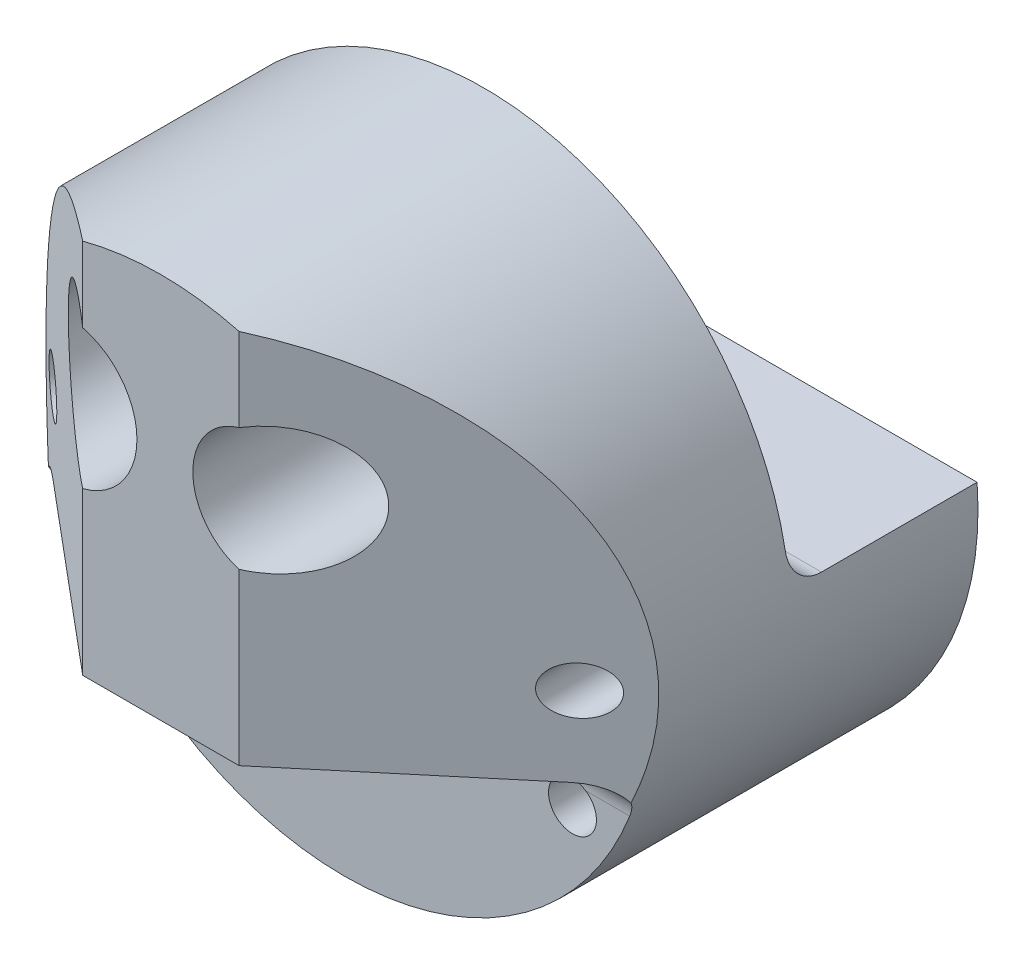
SolidWorks part; units mm, degrees
ref_plane "Front Plane" through (0, 0, 0) normal (0, 0, 1) x (1, 0, 0)
ref_plane "Top Plane" through (0, 0, 0) normal (0, 1, 0) x (1, 0, 0)
ref_plane "Right Plane" through (0, 0, 0) normal (1, 0, 0) x (0, 0, -1)
sketch "Sketch1" plane through (0, 0, 0) normal (0, 0, 1) x (1, 0, 0)
  circle A0 centre (0, 0) radius 60.96
  dimension "D1" = 121.92
extrude "Boss-Extrude1" add sketch "Sketch1" along normal blind 101.6
sketch "Sketch3" plane through (0, 0, 0) normal (0, 1, 0) x (1, 0, 0)
  line L0 (60.96, -63.5) -> (60.96, -101.6)
  line L1 (60.96, -101.6) -> (60.96, 0) construction
  line L2 (60.96, -101.6) -> (15.5542, -101.6)
  line L3 (-60.96, -101.6) -> (60.96, -101.6) construction
  line L4 (15.5542, -101.6) -> (60.96, -63.5)
  line L5 (60.96, -63.5) -> (-60.96, -63.5) construction
  line L6 (-60.96, 0) -> (-60.96, -101.6) construction
  line L7 (-60.96, -63.5) -> (-15.5542, -101.6)
  line L8 (-15.5542, -101.6) -> (-60.96, -101.6)
  line L9 (-60.96, -101.6) -> (-60.96, -63.5)
  dimension "D1" = 50
  dimension "D2" = 50
  dimension "D3" = 38.1
extrude "Cut-Extrude1" cut sketch "Sketch3" against normal through all and the other way through all
hole_wizard "1 (1) Diameter Hole1" positions "Sketch6" profile "Sketch5" hole size "1" standard "Ansi Inch"
sketch "Sketch6" plane through (0, 0, 0) normal (0, 0, -1) x (-1, 0, 0)
  point P4 (-19.05, 30.1625)
  dimension "D1" = 30.1625
  dimension "D3" = 19.05
sketch "Sketch5" plane through (19.05, 30.1625, 0) normal (1, 0, 0) x (0, 1, 0)
  line L0 (0, 0) -> (0, 101.6)
  line L1 (0, 101.6) -> (12.7, 101.6)
  line L2 (12.7, 101.6) -> (12.7, 0)
  line L5 (12.7, 0) -> (0, 0)
  line L11 (0, -6.35) -> (0, 107.95) construction
  dimension "Thru Hole Dia." = 25.4
  dimension "Thru Hole Depth" = 101.6
hole_wizard "1 1/8 Diameter Hole3" positions "Sketch15" profile "Sketch14" hole size "1" standard "ANSI Inch"
sketch "Sketch15" plane through (0, 0, 0) normal (0, 0, -1) x (-1, 0, 0)
  point P0 (19.05, 30.1625)
  dimension "D1" = 30.1625
  dimension "D2" = 19.05
sketch "Sketch14" plane through (-19.05, 30.1625, 0) normal (1, 0, 0) x (0, 1, 0)
  line L0 (0, 0) -> (0, 101.6)
  line L1 (0, 101.6) -> (14.2875, 101.6)
  line L2 (14.2875, 101.6) -> (14.2875, 0)
  line L5 (14.2875, 0) -> (0, 0)
  line L11 (0, -6.35) -> (0, 107.95) construction
  dimension "Thru Hole Dia." = 28.575
  dimension "Thru Hole Depth" = 101.6
sketch "Sketch4" plane through (0, 0, 0) normal (1, 0, 0) x (0, 0, -1)
  line L0 (0, 60.96) -> (-101.6, 60.96) construction
  line L1 (-37.3062, 60.96) -> (0, 60.96)
  line L2 (-37.3062, 60.96) -> (-37.3062, 11.1125)
  line L3 (-30.9562, 4.7625) -> (0, 4.7625)
  line L4 (0, 60.96) -> (0, 4.7625)
  line L6 (0, -60.96) -> (0, 60.96) construction
  arc A0 (-37.3062, 11.1125) -> (-30.9562, 4.7625) centre (-30.9562, 11.1125) ccw
  dimension "D1" = 6.35
  dimension "D3" = 4.7625
  dimension "D2" = 37.3062
extrude "Cut-Extrude2" cut sketch "Sketch4" against normal through all and the other way through all
sketch "Sketch7" plane through (0, 0, 0) normal (1, 0, 0) x (0, 0, -1)
  line L0 (-101.6, -60.96) -> (0, -60.96) construction
  line L1 (0, -31.75) -> (-33.3375, -31.75)
  line L2 (0, -31.75) -> (0, -60.96)
  line L3 (0, -60.96) -> (-39.6875, -60.96)
  line L4 (-39.6875, -38.1) -> (-39.6875, -60.96)
  line L5 (0, -60.96) -> (0, 4.7625) construction
  arc A0 (-33.3375, -31.75) -> (-39.6875, -38.1) centre (-33.3375, -38.1) ccw
  dimension "D3" = 6.35
  dimension "D1" = 31.75
  dimension "D2" = 39.6875
extrude "Cut-Extrude3" cut sketch "Sketch7" against normal mid plane 80.9625
sketch "Sketch8" plane through (0, 0, 0) normal (1, 0, 0) x (0, 0, -1)
  line L0 (-101.6, -60.96) -> (-39.6875, -60.96) construction
  line L1 (-65.0875, -60.96) -> (-101.6, -60.96)
  line L2 (-65.0875, -60.96) -> (-65.0875, -22.225)
  line L3 (-71.4375, -15.875) -> (-101.6, -15.875)
  line L4 (-101.6, -60.96) -> (-101.6, -15.875)
  line L5 (-37.3062, 60.96) -> (-101.6, 60.96) construction
  line L6 (-76.2, 60.96) -> (-101.6, 60.96) construction
  line L7 (-76.2, 60.96) -> (-76.2, 53.975) construction
  line L8 (-82.55, 47.625) -> (-101.6, 47.625) construction
  line L9 (-101.6, 60.96) -> (-101.6, 47.625) construction
  line L10 (-101.6, 44.0157) -> (-101.6, 58.9422) construction
  line L11 (-101.6, -58.9422) -> (-101.6, 16.3093) construction
  arc A0 (-65.0875, -22.225) -> (-71.4375, -15.875) centre (-71.4375, -22.225) ccw
  arc A1 (-76.2, 53.975) -> (-82.55, 47.625) centre (-82.55, 53.975) cw construction
  dimension "D3" = 6.35
  dimension "D4" = 6.35
  dimension "D1" = 15.875
  dimension "D2" = 36.5125
  dimension "D5" = 47.625
  dimension "D6" = 25.4
extrude "Cut-Extrude4" cut sketch "Sketch8" against normal through all and the other way through all
fillet "Fillet2" radius 6.35 6 edges at (40.4812, -31.75, 16.6688) (40.4812, -33.6099, 37.8276) (-40.4812, -31.75, 16.6688) (-40.4812, -33.6099, 37.8276) (40.4812, -41.8392, 39.6875) (-40.4812, -41.8392, 39.6875)
sketch "Sketch9" plane through (0, 0, 0) normal (0, 0, -1) x (-1, 0, 0)
  line L0 (0, 0) -> (-45.3689, -26.1938) construction
  line L1 (0, 0) -> (-70.3391, 0) construction
  line L2 (0, 0) -> (45.3689, -26.1938) construction
  line L3 (0, 0) -> (74.2481, 0) construction
  circle A0 centre (-52.3875, 0) radius 4.7625
  circle A1 centre (0, 0) radius 52.3875 construction
  circle A2 centre (52.3875, 0) radius 4.7625
  circle A3 centre (45.3689, -26.1938) radius 4.7625
  circle A4 centre (-45.3689, -26.1938) radius 4.7625
  dimension "D3" = 9.525
  dimension "D4" = 104.775
  dimension "D1" = 30
  dimension "D2" = 30
extrude "Cut-Extrude5" cut sketch "Sketch9" against normal through all from offset 57.15
hole_wizard "#10 Clearance Hole1" positions "Sketch11" profile "Sketch10" hole size "#10" standard "Ansi Inch"
sketch "Sketch11" plane through (0, 0, 0) normal (0, 0, -1) x (-1, 0, 0)
  point P0 (-52.3875, 0)
  point P3 (-45.3689, -26.1938)
  point P6 (45.3689, -26.1938)
  point P9 (52.3875, 0)
sketch "Sketch10" plane through (52.3875, 0, 0) normal (1, 0, 0) x (0, 1, 0)
  line L0 (0, 0) -> (0, 101.6)
  line L1 (0, 101.6) -> (2.5527, 101.6)
  line L2 (2.5527, 101.6) -> (2.5527, 0)
  line L5 (2.5527, 0) -> (0, 0)
  line L11 (0, -6.35) -> (0, 107.95) construction
  dimension "Thru Hole Dia." = 5.1054
  dimension "Thru Hole Depth" = 101.6
equation "\"Buoyancy\"=\"SW-Volume\"*(\"SW-Density\"-.037062)"
